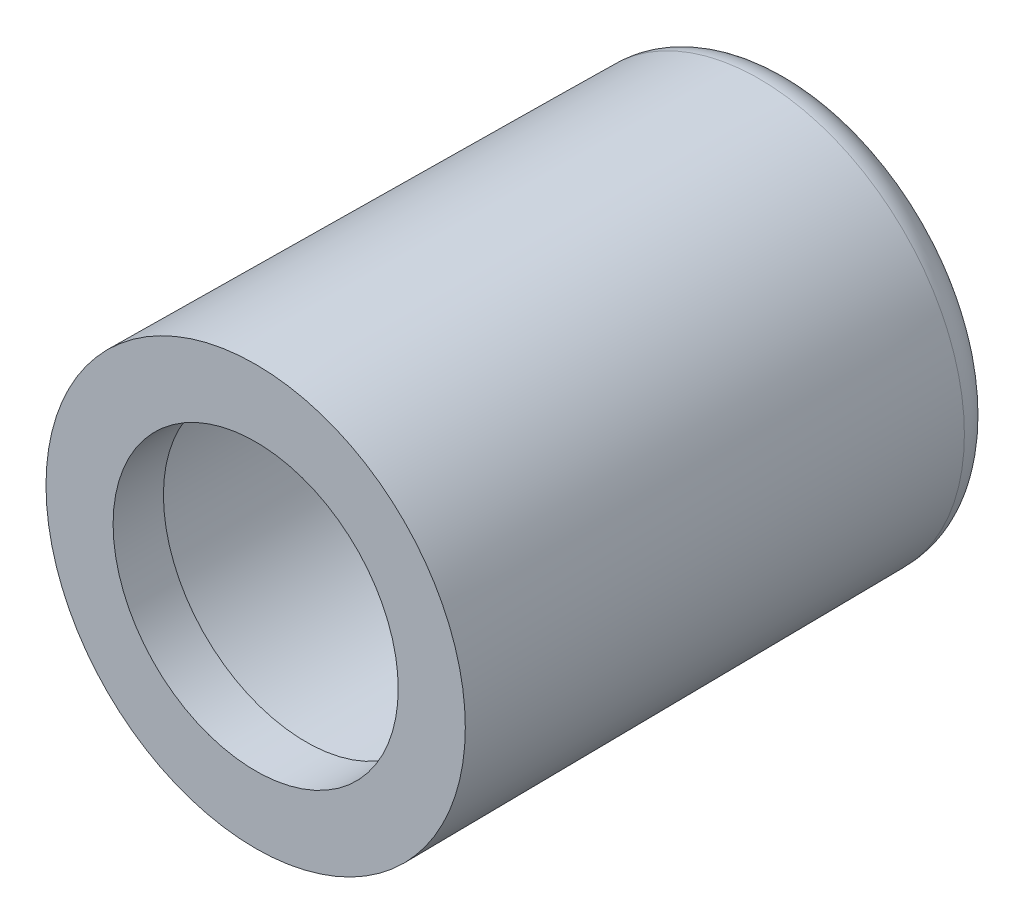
SolidWorks part; units mm, degrees
ref_plane "Plan1" through (0, 0, 0) normal (0, 0, 1) x (1, 0, 0)
ref_plane "Plan2" through (0, 0, 0) normal (0, 1, 0) x (1, 0, 0)
ref_plane "Plan3" through (0, 0, 0) normal (1, 0, 0) x (0, 0, -1)
sketch "Esquisse1" plane through (0, 0, 0) normal (0, 0, 1) x (1, 0, 0)
  circle A0 centre (0, 0) radius 12.5
  dimension "D1" = 25
extrude "Base-Extrusion" add sketch "Esquisse1" against normal blind 32 draft 0.5
sketch "Esquisse2" plane through (0, 0, -32) normal (0, 0, -1) x (-1, 0, 0)
  circle A0 centre (0, 0) radius 10
  dimension "D1" = 20
extrude "Enlèv. mat.-Extru.1" cut sketch "Esquisse2" against normal blind 29
sketch "Esquisse3" plane through (0, 0, -3) normal (0, 0, -1) x (-1, 0, 0)
  circle A0 centre (0, 0) radius 8.5
  dimension "D1" = 17
extrude "Enlèv. mat.-Extru.2" cut sketch "Esquisse3" against normal through all
fillet "Congé1" radius 2
